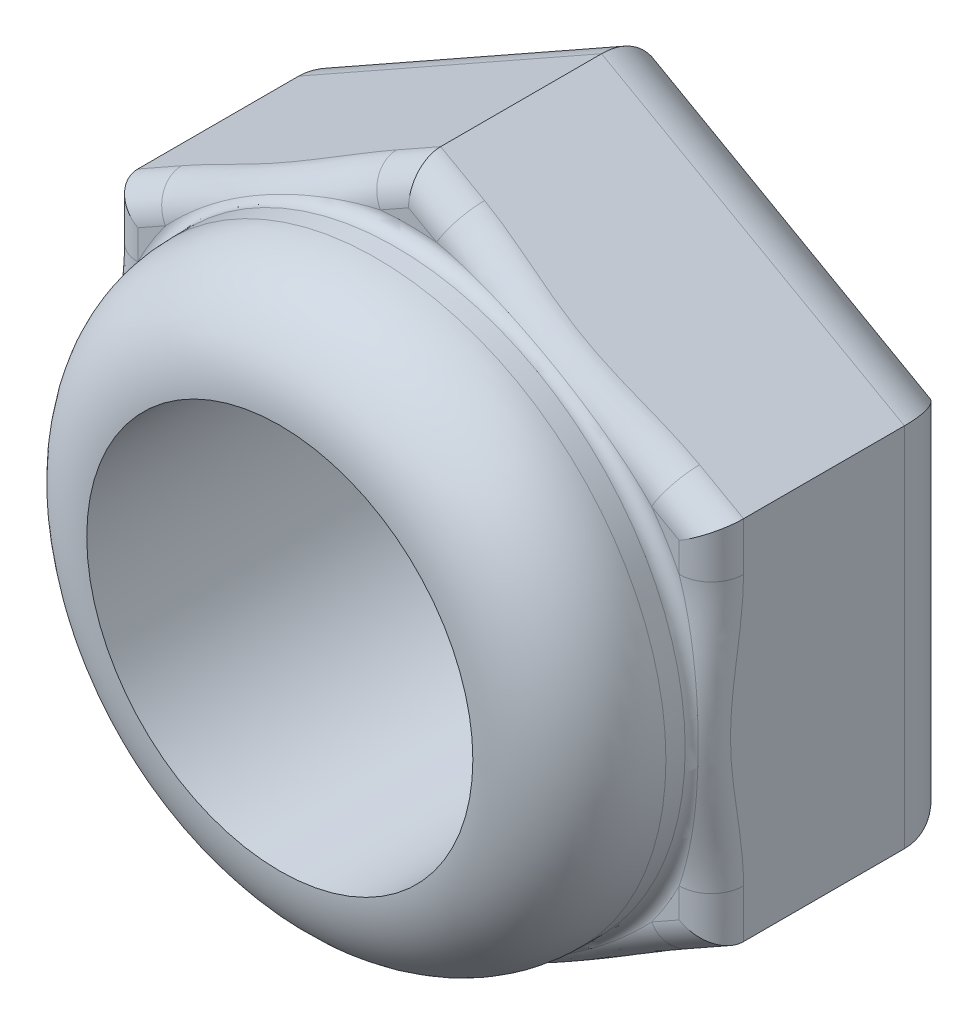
SolidWorks part; units mm, degrees
ref_plane "Plane1" through (0, 0, 0) normal (0, 0, 1) x (1, 0, 0)
ref_plane "Plane2" through (0, 0, 0) normal (0, 1, 0) x (1, 0, 0)
ref_plane "Plane3" through (0, 0, 0) normal (1, 0, 0) x (0, 0, -1)
sketch "Esquisse1" plane through (0, 0, 0) normal (0, 0, 1) x (1, 0, 0)
  line L0 (0, 10) -> (0, -10) construction
  line L1 (0, 5.5) -> (4.7065, 2.8459)
  line L2 (4.7065, 2.8459) -> (4.7065, -2.8459)
  line L3 (4.7065, -2.8459) -> (0, -5.5)
  line L4 (-4.7065, -2.8459) -> (0, -5.5)
  line L5 (-4.7065, 2.8459) -> (-4.7065, -2.8459)
  line L6 (0, 5.5) -> (-4.7065, 2.8459)
extrude "Base-Extrusion" add sketch "Esquisse1" along normal blind 4
sketch "Esquisse2" plane through (0, 0, 4) normal (0, 0, 1) x (1, 0, 0)
  circle A0 centre (0, 0) radius 4.5
  dimension "D1" = 9
extrude "Boss.-Extru.1" add sketch "Esquisse2" along normal blind 2
sketch "Esquisse3" plane through (0, 0, 6) normal (0, 0, 1) x (1, 0, 0)
  circle A0 centre (0, 0) radius 3
  dimension "D1" = 6
extrude "Enlèv. mat.-Extru.1" cut sketch "Esquisse3" against normal blind 12
fillet "Congé1" radius 1
chamfer "Chanfrein1" distance 0.5 angle 45
fillet "Congé3" radius 0.2
fillet "Congé5" radius 1.5
fillet "Congé6" radius 0.5
